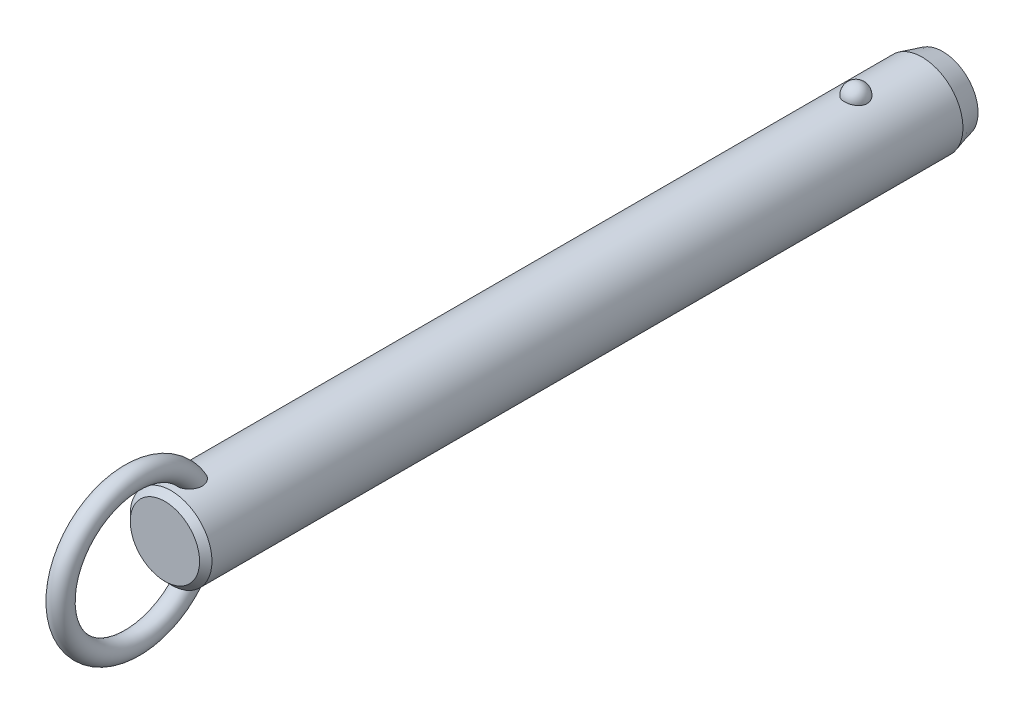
SolidWorks part; units mm, degrees
ref_plane "Front Plane" through (0, 0, 0) normal (0, 0, 1) x (1, 0, 0)
ref_plane "Top Plane" through (0, 0, 0) normal (0, 1, 0) x (1, 0, 0)
ref_plane "Right Plane" through (0, 0, 0) normal (1, 0, 0) x (0, 0, -1)
sketch "Sketch2" plane through (0, 0, 0) normal (0, 0, 1) x (1, 0, 0)
  circle A0 centre (0, 0) radius 7.9
  point P3 (0, 7.9)
  dimension "D1" = 15.8
extrude "Boss-Extrude1" add sketch "Sketch2" along normal blind 121.9
sketch "Sketch3" plane through (0, 0, 0) normal (0, 0, -1) x (-1, 0, 0)
  circle A0 centre (0, 0) radius 7.9
  dimension "D1" = 15.8
extrude "Boss-Extrude2" add sketch "Sketch3" along normal blind 19
chamfer "Chamfer1" distance 4 angle 15 1 edges at (-7.9, 0, -19)
sketch "Sketch12" plane through (0, 0, 0) normal (1, 0, 0) x (0, 0, -1)
  line L0 (-121.9, 7.9) -> (-121.9, -7.9) construction
  point P0 (-121.9, 0)
sketch "Sketch13" plane through (0, 0, 0) normal (1, 0, 0) x (0, 0, -1)
  circle A0 centre (-137.75, 0) radius 15.85
  point P2 (-121.9, 0)
  dimension "D1" = 31.7
sketch "Sketch14" plane through (0, 0, 0) normal (0, 1, 0) x (1, 0, 0)
  circle A0 centre (0, -123.9) radius 2
  point P2 (0, -121.9)
  dimension "D1" = 4
sweep "Sweep1" add profiles "Sketch14" path "Sketch13"
sketch "Sketch15" plane through (0, 0, 121.9) normal (0, 0, 1) x (1, 0, 0)
  circle A0 centre (0, 0) radius 7.9
  dimension "D1" = 15.8
extrude "Boss-Extrude3" add sketch "Sketch15" along normal blind 9.52
chamfer "Chamfer2" distance 1.2 angle 45 1 edges at (7.9, 0, 131.42)
sketch "Sketch18" plane through (0, 0, 0) normal (1, 0, 0) x (0, 0, -1)
  line L0 (15, 7.9) -> (-124.0091, 7.9) construction
  line L1 (2.2, 10.1) -> (2.2, 5.7)
  line L2 (-124.0091, -7.9) -> (15, -7.9) construction
  arc A0 (2.2, 10.1) -> (2.2, 5.7) centre (2.2, 7.9) ccw
  point P4 (0, 7.9)
  dimension "D1" = 18
revolve "Revolve1" add sketch "Sketch18" angle 360 about L1
